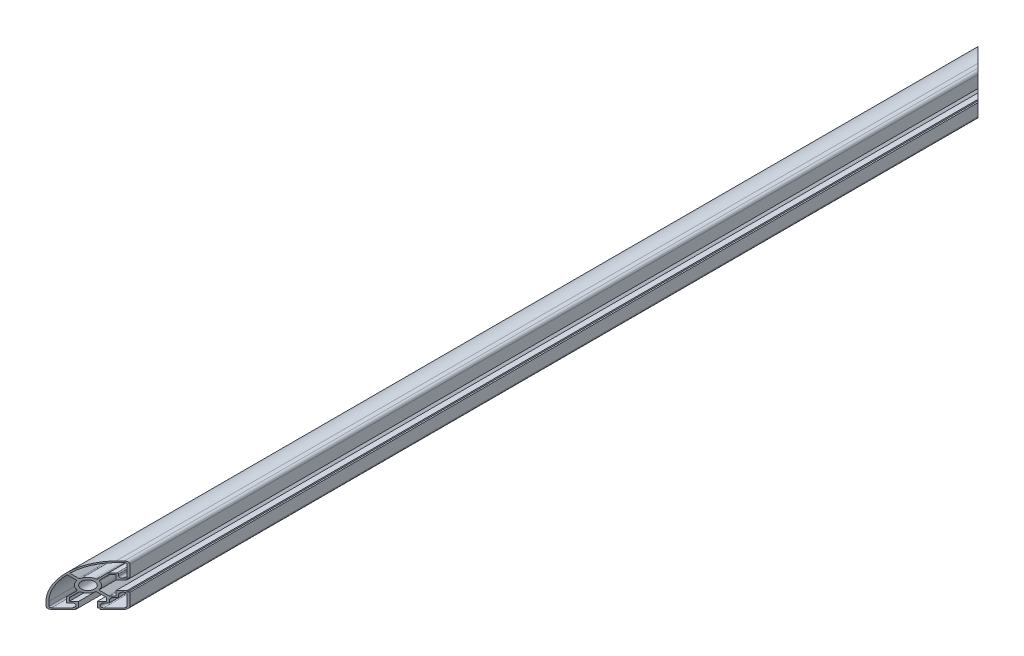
SolidWorks part; units mm, degrees
ref_plane "Ebene vorne" through (0, 0, 0) normal (0, 0, 1) x (1, 0, 0)
ref_plane "Ebene oben" through (0, 0, 0) normal (0, 1, 0) x (1, 0, 0)
ref_plane "Ebene rechts" through (0, 0, 0) normal (1, 0, 0) x (0, 0, -1)
sketch "Skizze1" plane through (0, 0, 0) normal (0, 0, 1) x (1, 0, 0)
  line L0 (-3, 0) -> (-16, 0)
  line L1 (0, 3) -> (0, 16)
  line L2 (-3, 45) -> (-7.5, 45)
  line L3 (-45, 3) -> (-45, 7.5)
  line L4 (-27.5, 1.5) -> (-27.5, 7.5)
  line L5 (-32.5, 7.5) -> (-32.5, 10.6716)
  line L6 (-32.5, 7.5) -> (-27.5, 7.5)
  line L7 (-27.5018, 16.084) -> (-32.2071, 11.3787)
  line L8 (0, 0) -> (-41.2602, 41.2602) construction
  line L9 (-22.5, -8.66) -> (-22.5, 55.2654) construction
  line L10 (-12.5, 7.5) -> (-12.5, 10.6716)
  line L11 (-17.5, 1.5) -> (-17.5, 7.5)
  line L12 (-12.5, 7.5) -> (-17.5, 7.5)
  line L13 (-18.0813, 16.6671) -> (-12.7929, 11.3787)
  line L14 (0.7071, 0.7071) -> (-0.2929, 1.7071)
  line L15 (-0.7071, -0.7071) -> (-1.7071, 0.2929)
  line L16 (0.7071, 0.7071) -> (-40.5531, 41.9673) construction
  line L17 (-0.7071, -0.7071) -> (-41.9673, 40.5531) construction
  line L18 (-28.916, 27.5018) -> (-33.6531, 32.2389)
  line L19 (-27.5018, 28.916) -> (-32.2389, 33.6531)
  line L20 (0, 16) -> (-6, 16) construction
  line L21 (-16.6671, 18.0813) -> (-11.3787, 12.7929)
  line L22 (-7.5, 12.5) -> (-10.6716, 12.5)
  line L23 (-7.5, 12.5) -> (-7.5, 17.5)
  line L24 (-1.5, 17.5) -> (-7.5, 17.5)
  line L25 (-1.5, 27.5) -> (-7.5, 27.5)
  line L26 (-7.5, 32.5) -> (-7.5, 27.5)
  line L27 (-7.5, 32.5) -> (-10.6716, 32.5)
  line L28 (-16.084, 27.5018) -> (-11.3787, 32.2071)
  line L29 (-17.0207, 17.7278) -> (-16.9842, 17.6913)
  line L30 (-11, 6) -> (-11, 9)
  line L31 (-11, 6) -> (-14, 6)
  line L32 (-16, 3.5) -> (-16, 4)
  line L33 (-3.5, 16) -> (-4, 16)
  line L34 (-6, 11) -> (-6, 14)
  line L35 (-6, 11) -> (-9, 11)
  line L36 (-17.7278, 17.0207) -> (-17.6913, 16.9842)
  line L37 (-3, 1.5) -> (-14, 1.5)
  line L38 (-43.5, 3) -> (-43.5, 7.5)
  line L39 (-3, 43.5) -> (-7.5, 43.5)
  line L40 (-1.5, 3) -> (-1.5, 14)
  line L41 (-11, 6) -> (-11, 11.7071) construction
  line L42 (-6, 11) -> (-11.7071, 11) construction
  line L43 (-17.0207, 17.7278) -> (-11, 11.7071) construction
  line L44 (-17.7278, 17.0207) -> (-11.7071, 11) construction
  line L45 (0, 17.5) -> (-7.5, 17.5) construction
  line L46 (-16, 0) -> (-16, 6) construction
  line L47 (-17.5, 0) -> (-17.5, 7.5) construction
  line L48 (-11, 6) -> (-16, 6) construction
  line L49 (-3, 1.5) -> (-42, 1.5) construction
  line L50 (-1.5, 3) -> (-1.5, 42) construction
  line L51 (-6, 11) -> (-6, 16) construction
  line L52 (0, 27.5) -> (-7.5, 27.5) construction
  line L55 (-42, 1.5) -> (-31, 1.5)
  line L56 (-1.5, 42) -> (-1.5, 31)
  line L57 (-3.5, 29) -> (-4, 29)
  line L58 (-6, 33) -> (-6, 31)
  line L59 (-7, 34) -> (-11.2929, 34)
  line L60 (-17.0686, 28.6385) -> (-12, 33.7071)
  line L61 (-28.6385, 17.0686) -> (-34, 11.7071)
  line L62 (-34, 6) -> (-34, 11.7071)
  line L63 (-34, 6) -> (-31, 6)
  line L64 (-29, 3.5) -> (-29, 4)
  line L65 (0, 29) -> (-6, 29) construction
  line L66 (-17.7278, 27.9793) -> (-11.7071, 34) construction
  line L67 (-16.6671, 26.9187) -> (-11.0858, 32.5) construction
  line L68 (-26.9187, 16.6671) -> (-32.5, 11.0858) construction
  line L69 (-27.9793, 17.7278) -> (-34, 11.7071) construction
  line L70 (-29, 1.5) -> (-29, 6) construction
  line L71 (-34, 6) -> (-29, 6) construction
  line L72 (-6, 34) -> (-6, 29) construction
  line L73 (-6, 34) -> (-11.7071, 34) construction
  line L74 (-7.5, 32.5) -> (-11.0858, 32.5) construction
  line L75 (-32.5, 7.5) -> (-32.5, 11.0858) construction
  line L76 (-12.5, 7.5) -> (-12.5, 11.0858) construction
  line L77 (-18.0813, 16.6671) -> (-12.5, 11.0858) construction
  line L78 (-7.5, 12.5) -> (-11.0858, 12.5) construction
  line L79 (-16.6671, 18.0813) -> (-11.0858, 12.5) construction
  line L80 (0, 29) -> (0, 42)
  line L81 (0, 3) -> (0, 42) construction
  line L82 (-29, 0) -> (-42, 0)
  line L83 (-3, 0) -> (-42, 0) construction
  line L84 (-1.5, 17.5) -> (-1.5, 16)
  line L85 (-27.5, 1.5) -> (-29, 1.5)
  line L86 (-1.5, 16) -> (0, 16)
  line L88 (-29, 1.5) -> (-29, 0)
  line L89 (-17.5, 1.5) -> (-16, 1.5)
  line L92 (-16, 1.5) -> (-16, 0)
  line L95 (0, 29) -> (-1.5, 29)
  line L96 (-1.5, 27.5) -> (-1.5, 29)
  arc A0 (-7.5, 45) -> (-45, 7.5) centre (-7.5, 7.5) ccw
  circle A1 centre (-22.5, 22.5) radius 5
  arc A2 (-45, 3) -> (-42, 0) centre (-42, 3) ccw
  arc A3 (0, 42) -> (-3, 45) centre (-3, 42) ccw
  arc A4 (0, 3) -> (-3, 0) centre (-3, 3) cw
  arc A5 (-28.7667, 26.2783) -> (-28.5226, 18.3437) centre (-22.5, 22.5) ccw
  arc A6 (-43.5, 3) -> (-42, 1.5) centre (-42, 3) ccw
  arc A7 (-7.5, 43.5) -> (-32.2389, 33.6531) centre (-7.5, 7.5) ccw
  arc A8 (-1.5, 42) -> (-3, 43.5) centre (-3, 42) ccw
  arc A9 (-1.5, 3) -> (-3, 1.5) centre (-3, 3) cw
  arc A10 (-9, 11) -> (-11, 9) centre (-9, 9) ccw
  arc A11 (-16, 4) -> (-14, 6) centre (-14, 4) cw
  arc A12 (-14, 1.5) -> (-16, 3.5) centre (-14, 3.5) cw
  arc A13 (-1.5, 14) -> (-3.5, 16) centre (-3.5, 14) ccw
  arc A14 (-6, 14) -> (-4, 16) centre (-4, 14) cw
  arc A15 (-33.6531, 32.2389) -> (-43.5, 7.5) centre (-7.5, 7.5) ccw
  arc A16 (-7.5, 43.5) -> (-43.5, 7.5) centre (-7.5, 7.5) ccw construction
  arc A17 (-26.2783, 16.2333) -> (-16.2333, 26.2783) centre (-22.5, 22.5) ccw
  arc A18 (-18.3437, 28.5226) -> (-26.2783, 28.7667) centre (-22.5, 22.5) ccw
  arc A19 (-26.2783, 28.7667) -> (-27.5018, 28.916) centre (-26.7946, 29.6231) cw
  arc A20 (-18.3437, 28.5226) -> (-17.0686, 28.6385) centre (-17.7757, 29.3456) ccw
  arc A21 (-16.2333, 26.2783) -> (-16.084, 27.5018) centre (-15.3769, 26.7946) cw
  arc A22 (-27.5018, 16.084) -> (-26.2783, 16.2333) centre (-26.7946, 15.3769) cw
  arc A23 (-28.5226, 18.3437) -> (-28.6385, 17.0686) centre (-29.3456, 17.7757) cw
  arc A24 (-29, 4) -> (-31, 6) centre (-31, 4) ccw
  arc A25 (-29, 3.5) -> (-31, 1.5) centre (-31, 3.5) cw
  arc A26 (-4, 29) -> (-6, 31) centre (-4, 31) cw
  arc A27 (-3.5, 29) -> (-1.5, 31) centre (-3.5, 31) ccw
  arc A28 (-6, 33) -> (-7, 34) centre (-7, 33) ccw
  arc A29 (-12, 33.7071) -> (-11.2929, 34) centre (-11.2929, 33) cw
  arc A30 (-10.6716, 32.5) -> (-11.3787, 32.2071) centre (-10.6716, 31.5) ccw
  arc A31 (-32.5, 10.6716) -> (-32.2071, 11.3787) centre (-31.5, 10.6716) cw
  arc A32 (-12.5, 10.6716) -> (-12.7929, 11.3787) centre (-13.5, 10.6716) ccw
  arc A33 (-10.6716, 12.5) -> (-11.3787, 12.7929) centre (-10.6716, 13.5) cw
  arc A34 (-28.7667, 26.2783) -> (-28.916, 27.5018) centre (-29.6231, 26.7946) ccw
  point P3 (-7.5, 7.5)
  point P12 (-45, 0)
  point P15 (0, 45)
  point P18 (0, 0)
  point P85 (-11, 11)
  point P118 (-16.6671, 26.9187)
  point P122 (-26.9187, 16.6671)
  point P151 (-12.5, 11.0858)
  point P155 (-11.0858, 12.5)
  dimension "D1" = 7.5
  dimension "D3" = 75
  dimension "D6" = 10
  dimension "D7" = 3
  dimension "D13" = 2
  dimension "D15" = 1
  dimension "D16" = 2
  dimension "D17" = 1
  dimension "D18" = 1
  dimension "GrößeProfil" = 45
  dimension "D2" = 7.5
  dimension "D4" = 22.5
  dimension "D5" = 22.5
  dimension "D8" = 5
  dimension "D9" = 5
  dimension "D10" = 1.5
  dimension "D11" = 1
  dimension "D12" = 1
  dimension "D14" = 1.5
extrude "Linear austragen1" add sketch "Skizze1" along normal up to vertex (464.3409 mm away) from vertex
sketch "Skizze5" plane through (0, 0, 0) normal (0, -1, 0) x (1, 0, 0)
  line L0 (-45, 1560.8568) -> (0, 1605.8568)
  line L1 (0, 2560.8568) -> (0, 1560.8568) construction
  line L2 (0, 1605.8568) -> (0, 1560.8568)
  line L3 (0, 1560.8568) -> (-45, 1560.8568)
  line L4 (-45, 2560.8568) -> (0, 2515.8568)
  line L6 (0, 2515.8568) -> (0, 2560.8568)
  line L7 (0, 2560.8568) -> (-45, 2560.8568)
  dimension "D1" = 45
  dimension "D2" = 45
extrude "Schnitt-Linear austragen2" cut sketch "Skizze5" against normal blind 74.3573
